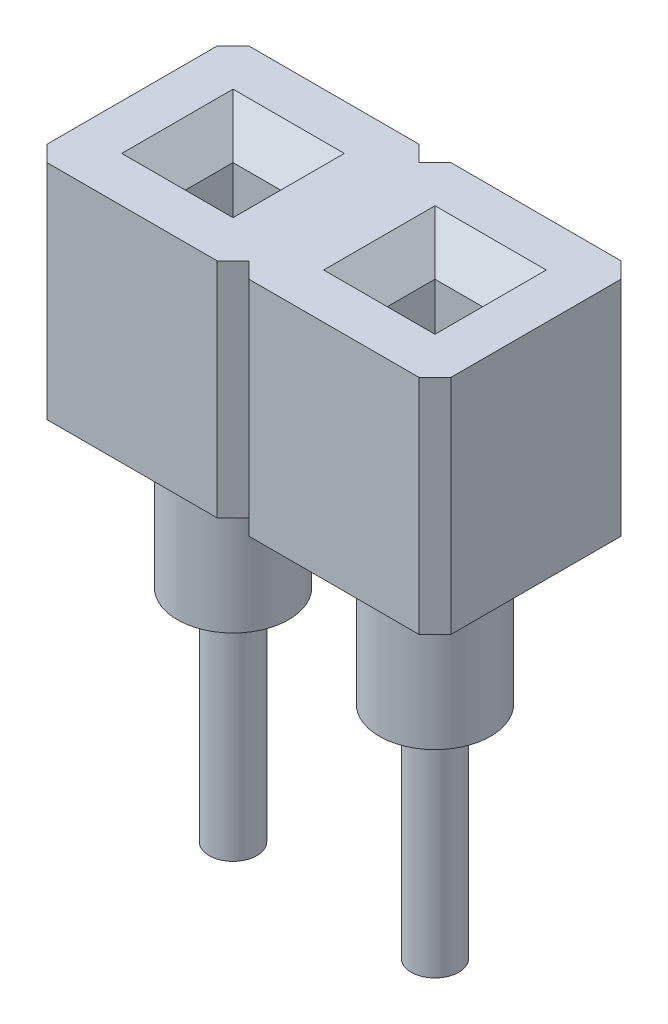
SolidWorks part; units mm, degrees
ref_plane "Plan de face" through (0, 0, 0) normal (0, 0, 1) x (1, 0, 0)
ref_plane "Plan de dessus" through (0, 0, 0) normal (0, 1, 0) x (1, 0, 0)
ref_plane "Plan de droite" through (0, 0, 0) normal (1, 0, 0) x (0, 0, -1)
sketch "Esquisse1" plane through (0, 0, 0) normal (0, 1, 0) x (1, 0, 0)
  line L1 (-0.3, 0.3) -> (0.3, 0.3)
  line L2 (-0.3, 0.3) -> (-0.3, -0.3)
  line L3 (-0.3, -0.3) -> (0.3, -0.3)
  line L4 (0.3, 0.3) -> (0.3, -0.3)
  line L7 (1.27, 1.07) -> (1.27, -1.07)
  line L9 (-1.07, 1.27) -> (1.07, 1.27)
  line L10 (-1.27, 1.07) -> (-1.27, -1.07)
  line L12 (1.07, 1.27) -> (1.27, 1.07)
  line L13 (-1.07, 1.27) -> (-1.27, 1.07)
  line L14 (-1.27, -1.07) -> (-1.07, -1.27)
  line L15 (1.27, -1.07) -> (1.07, -1.27)
  line L16 (-1.07, -1.27) -> (1.07, -1.27)
  dimension "D1" = 0.6
  dimension "D2" = 0.6
extrude "Extrusion1" add sketch "Esquisse1" along normal blind 2.8
sketch "Esquisse2" plane through (0, 0, 0) normal (0, 0, 1) x (1, 0, 0)
  line L0 (0, 0) -> (0, -4.7)
  line L1 (0, -4.7) -> (0.3, -4.7)
  line L2 (0.3, -4.7) -> (0.3, -2.2)
  line L3 (0.3, -2.2) -> (0.7, -1.93)
  line L4 (0.7, -1.93) -> (0.7, 0)
  line L5 (-1.07, 0) -> (1.07, 0) construction
  line L6 (0.7, 0) -> (0, 0)
  line L7 (-1.07, 2.8) -> (1.07, 2.8) construction
  dimension "D1" = 7.5
  dimension "D2" = 5
  dimension "D3" = 0.7
  dimension "D4" = 0.3
  dimension "D5" = 0.27
revolve "Révolution1" add sketch "Esquisse2" angle 360 about L0
chamfer "Chanfrein1" distance 0.4 angle 45 4 edges at (-0.3, 2.8, 0) (0, 2.8, 0.3) (0.3, 2.8, 0) (0, 2.8, -0.3)
ref_plane "Plan1" through (0, -4.1, 0) normal (0, -1, 0) x (1, 0, 0)
pattern_linear "Répétition linéaire1" count 2 spacing 2.54 along (-1, 0, 0) of "Chanfrein1", "Révolution1", "Extrusion1"
